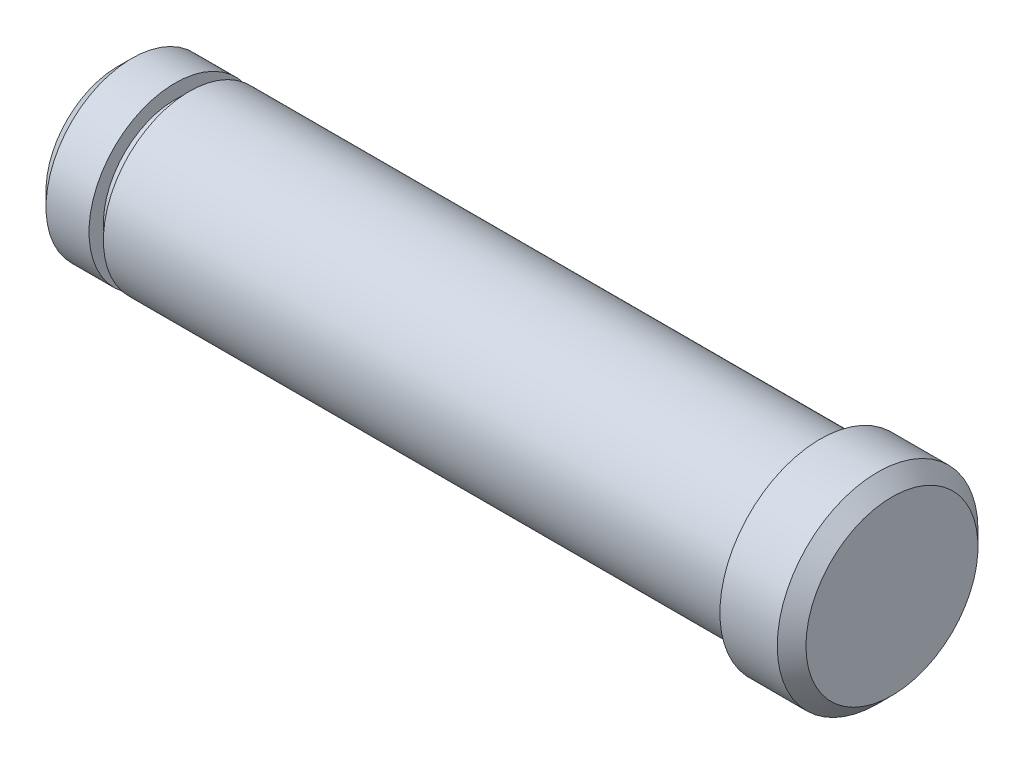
SolidWorks part; units mm, degrees
ref_plane "Front Plane" through (0, 0, 0) normal (0, 0, 1) x (1, 0, 0)
ref_plane "Top Plane" through (0, 0, 0) normal (0, 1, 0) x (1, 0, 0)
ref_plane "Right Plane" through (0, 0, 0) normal (1, 0, 0) x (0, 0, -1)
sketch "Szkic1" plane through (0, 0, 0) normal (0, 0, 1) x (1, 0, 0)
  line L0 (0, 0) -> (-50000, 0) construction
  line L1 (0, 0) -> (0, 6)
  line L2 (0, 6) -> (4, 6)
  line L3 (49, 6) -> (49, 7)
  line L4 (4, 5) -> (5, 5)
  line L5 (4, 6) -> (4, 5)
  line L6 (4, 5) -> (5, 5)
  line L7 (5, 5) -> (5, 6)
  line L8 (5, 6) -> (49, 6)
  line L9 (49, 7) -> (54, 7)
  line L10 (54, 7) -> (54, 0)
  line L11 (0, 0) -> (54, 0)
  dimension "D1" = 6
  dimension "D2" = 4
  dimension "D3" = 12
  dimension "D4" = 5
  dimension "D5" = 1
  dimension "D6" = 44
  dimension "D7" = 5
  dimension "D8" = 7
revolve "Obrót1" add sketch "Szkic1" angle 360 about L0
chamfer "Sfazowanie1" distance 1 angle 45 2 edges at (54, 0, -7) (0, 0, -6)
